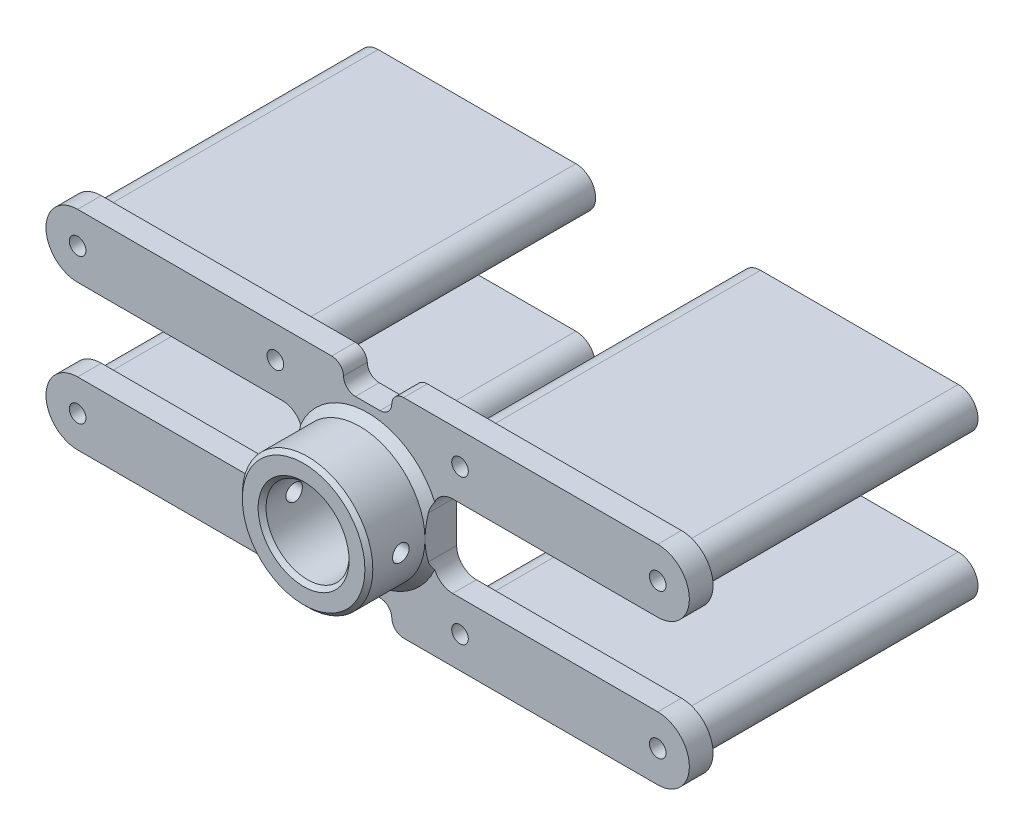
SolidWorks part; units mm, degrees
ref_plane "Top Plane" through (0, 0, 0) normal (0, 0, 1) x (1, 0, 0)
ref_plane "Front Plane" through (0, 0, 0) normal (0, 1, 0) x (1, 0, 0)
ref_plane "Right Plane" through (0, 0, 0) normal (1, 0, 0) x (0, 0, -1)
sketch "Sketch11" plane through (0, 0, 0) normal (0, 0, 1) x (1, 0, 0)
  line L0 (0, 57.5672) -> (0, -57.5672) construction
  line L1 (-89.7236, 0) -> (89.7236, 0) construction
  line L2 (-73.35, 18.35) -> (-23.35, 18.35) construction
  line L3 (-73.35, 23.35) -> (-23.35, 23.35)
  line L4 (-73.35, 13.35) -> (-23.35, 13.35)
  line L5 (-18.35, 18.35) -> (-18.35, 0) construction
  line L6 (-18.35, 18.35) -> (0, 18.35) construction
  line L7 (-73.35, -18.35) -> (-23.35, -18.35) construction
  line L8 (-73.35, -23.35) -> (-23.35, -23.35)
  line L9 (-73.35, -13.35) -> (-23.35, -13.35)
  line L10 (73.35, 18.35) -> (23.35, 18.35) construction
  line L11 (73.35, 23.35) -> (23.35, 23.35)
  line L12 (73.35, 13.35) -> (23.35, 13.35)
  line L13 (73.35, -18.35) -> (23.35, -18.35) construction
  line L14 (73.35, -23.35) -> (23.35, -23.35)
  line L15 (73.35, -13.35) -> (23.35, -13.35)
  arc A0 (-73.35, 23.35) -> (-73.35, 13.35) centre (-73.35, 18.35) ccw
  arc A1 (-23.35, 13.35) -> (-23.35, 23.35) centre (-23.35, 18.35) ccw
  arc A2 (-73.35, -23.35) -> (-73.35, -13.35) centre (-73.35, -18.35) cw
  arc A3 (-23.35, -13.35) -> (-23.35, -23.35) centre (-23.35, -18.35) cw
  arc A4 (73.35, 23.35) -> (73.35, 13.35) centre (73.35, 18.35) cw
  arc A5 (23.35, 13.35) -> (23.35, 23.35) centre (23.35, 18.35) cw
  arc A6 (73.35, -23.35) -> (73.35, -13.35) centre (73.35, -18.35) ccw
  arc A7 (23.35, -13.35) -> (23.35, -23.35) centre (23.35, -18.35) ccw
  point P4 (0, 0)
  point P8 (0, 0)
  point P10 (-48.35, 18.35)
  point P19 (-48.35, -18.35)
  point P26 (48.35, 18.35)
  point P33 (48.35, -18.35)
extrude "Boss-Extrude6" add sketch "Sketch11" along normal blind 70
sketch "Sketch12" plane through (0, 0, 70) normal (0, 0, 1) x (1, 0, 0)
  line L0 (73.35, -13.35) -> (23.35, -13.35) construction
  line L1 (23.35, -23.35) -> (73.35, -23.35) construction
  line L2 (73.35, 23.35) -> (23.35, 23.35) construction
  line L3 (23.35, 13.35) -> (73.35, 13.35) construction
  line L4 (-73.35, 13.35) -> (-23.35, 13.35) construction
  line L5 (-23.35, 23.35) -> (-73.35, 23.35) construction
  line L6 (-73.35, -23.35) -> (-23.35, -23.35) construction
  line L7 (-23.35, -13.35) -> (-73.35, -13.35) construction
  line L8 (73.35, -13.35) -> (23.35, -13.35) construction
  line L9 (23.35, -23.35) -> (73.35, -23.35) construction
  line L10 (73.35, 23.35) -> (23.35, 23.35) construction
  line L11 (23.35, 13.35) -> (73.35, 13.35) construction
  line L12 (-73.35, 13.35) -> (-23.35, 13.35) construction
  line L13 (-23.35, 23.35) -> (-73.35, 23.35) construction
  line L14 (-73.35, -23.35) -> (-23.35, -23.35) construction
  line L15 (-23.35, -13.35) -> (-73.35, -13.35) construction
  line L16 (-73.35, -26.35) -> (-23.35, -26.35)
  line L17 (-21.5, -10.35) -> (-73.35, -10.35)
  line L18 (-23.35, 26.35) -> (-73.35, 26.35)
  line L19 (-73.35, 10.35) -> (-21.5, 10.35)
  line L20 (73.35, 26.35) -> (23.35, 26.35)
  line L21 (21.5, 10.35) -> (73.35, 10.35)
  line L22 (73.35, -10.35) -> (21.5, -10.35)
  line L23 (23.35, -26.35) -> (73.35, -26.35)
  line L24 (-16.5, 5.35) -> (-16.5, -5.35)
  line L25 (-23.35, -26.35) -> (-9.1, -26.35)
  line L26 (16.5, -5.35) -> (16.5, 5.35)
  line L27 (23.35, 26.35) -> (9.1, 26.35)
  line L28 (23.35, 10.35) -> (73.35, 10.35) construction
  line L29 (73.35, -10.35) -> (23.35, -10.35) construction
  line L30 (-23.35, -10.35) -> (-73.35, -10.35) construction
  line L31 (-73.35, 10.35) -> (-23.35, 10.35) construction
  line L32 (0, 10.5) -> (0, 20.5) construction
  line L33 (0, -10.5) -> (0, -20.5) construction
  line L34 (-10.5, 26.35) -> (-10.5, -26.35) construction
  line L35 (10.5, 26.35) -> (10.5, -26.35) construction
  line L36 (-3.1, -20.5) -> (3.1, -20.5)
  line L37 (-3.1, 20.5) -> (3.1, 20.5)
  line L38 (-6.1, 23.5) -> (-6.1, 23.35)
  line L39 (6.1, 23.5) -> (6.1, 23.35)
  line L40 (6.1, -23.5) -> (6.1, -23.35)
  line L41 (-6.1, -23.5) -> (-6.1, -23.35)
  line L42 (-9.1, 26.35) -> (-23.35, 26.35)
  line L43 (9.1, -26.35) -> (23.35, -26.35)
  arc A0 (73.35, -23.35) -> (73.35, -13.35) centre (73.35, -18.35) ccw construction
  arc A1 (23.35, -13.35) -> (23.35, -23.35) centre (23.35, -18.35) ccw construction
  arc A2 (73.35, 13.35) -> (73.35, 23.35) centre (73.35, 18.35) ccw construction
  arc A3 (23.35, 23.35) -> (23.35, 13.35) centre (23.35, 18.35) ccw construction
  arc A4 (-73.35, 23.35) -> (-73.35, 13.35) centre (-73.35, 18.35) ccw construction
  arc A5 (-23.35, 13.35) -> (-23.35, 23.35) centre (-23.35, 18.35) ccw construction
  arc A6 (-73.35, -13.35) -> (-73.35, -23.35) centre (-73.35, -18.35) ccw construction
  arc A7 (-23.35, -23.35) -> (-23.35, -13.35) centre (-23.35, -18.35) ccw construction
  arc A8 (73.35, -23.35) -> (73.35, -13.35) centre (73.35, -18.35) ccw construction
  arc A9 (23.35, -13.35) -> (23.35, -23.35) centre (23.35, -18.35) ccw construction
  arc A10 (73.35, 13.35) -> (73.35, 23.35) centre (73.35, 18.35) ccw construction
  arc A11 (23.35, 23.35) -> (23.35, 13.35) centre (23.35, 18.35) ccw construction
  arc A12 (-73.35, 23.35) -> (-73.35, 13.35) centre (-73.35, 18.35) ccw construction
  arc A13 (-23.35, 13.35) -> (-23.35, 23.35) centre (-23.35, 18.35) ccw construction
  arc A14 (-73.35, -13.35) -> (-73.35, -23.35) centre (-73.35, -18.35) ccw construction
  arc A15 (-23.35, -23.35) -> (-23.35, -13.35) centre (-23.35, -18.35) ccw construction
  circle A16 centre (0, 0) radius 10.5
  arc A17 (-73.35, -10.35) -> (-73.35, -26.35) centre (-73.35, -18.35) ccw
  arc A19 (-73.35, 26.35) -> (-73.35, 10.35) centre (-73.35, 18.35) ccw
  arc A22 (73.35, 10.35) -> (73.35, 26.35) centre (73.35, 18.35) ccw
  arc A24 (73.35, -26.35) -> (73.35, -10.35) centre (73.35, -18.35) ccw
  arc A25 (-23.35, 10.35) -> (-23.35, 26.35) centre (-23.35, 18.35) ccw construction
  arc A26 (-23.35, -26.35) -> (-23.35, -10.35) centre (-23.35, -18.35) ccw construction
  arc A27 (23.35, -10.35) -> (23.35, -26.35) centre (23.35, -18.35) ccw construction
  arc A28 (23.35, 26.35) -> (23.35, 10.35) centre (23.35, 18.35) ccw construction
  arc A29 (16.5, 5.35) -> (21.5, 10.35) centre (21.5, 5.35) cw
  arc A30 (21.5, -10.35) -> (16.5, -5.35) centre (21.5, -5.35) cw
  arc A31 (-21.5, -10.35) -> (-16.5, -5.35) centre (-21.5, -5.35) ccw
  arc A32 (-16.5, 5.35) -> (-21.5, 10.35) centre (-21.5, 5.35) ccw
  arc A33 (9.1, -26.35) -> (6.1, -23.35) centre (9.1, -23.35) cw
  arc A34 (6.1, -23.5) -> (3.1, -20.5) centre (3.1, -23.5) ccw
  arc A35 (-6.1, -23.5) -> (-3.1, -20.5) centre (-3.1, -23.5) cw
  arc A36 (-6.1, -23.35) -> (-9.1, -26.35) centre (-9.1, -23.35) cw
  arc A37 (9.1, 26.35) -> (6.1, 23.35) centre (9.1, 23.35) ccw
  arc A38 (6.1, 23.5) -> (3.1, 20.5) centre (3.1, 23.5) cw
  arc A39 (-3.1, 20.5) -> (-6.1, 23.5) centre (-3.1, 23.5) cw
  arc A40 (-6.1, 23.35) -> (-9.1, 26.35) centre (-9.1, 23.35) ccw
  point P70 (-10.5, 0)
  point P73 (10.5, 0)
  point P76 (0, -20.5)
  point P79 (0, 20.5)
  point P85 (6.1, -26.35)
  point P96 (6.1, 20.5)
  point P99 (-6.1, 20.5)
  point P102 (-6.1, 26.35)
extrude "Boss-Extrude7" add sketch "Sketch12" along normal blind 6 separate body
sketch "Sketch13" plane through (0, 0, 76) normal (0, 0, 1) x (1, 0, 0)
  circle A0 centre (0, 0) radius 10.5 construction
  circle A1 centre (0, 0) radius 10.5
  circle A2 centre (0, 0) radius 16.5
extrude "Boss-Extrude8" add sketch "Sketch13" along normal blind 16.2
sketch "Sketch14" plane through (0, 0, 0) normal (1, 0, 0) x (0, 0, -1)
  line L0 (-76, 0) -> (-76, -16.5) construction
  line L1 (-76, 0) -> (-76, -16.5) construction
  line L2 (-92.2, 16.5) -> (-92.2, -16.5) construction
  line L3 (-92.2, 16.5) -> (-92.2, -16.5) construction
  line L4 (-92.2, 0) -> (-55.527, 0) construction
  circle A0 centre (-84.1, 0) radius 2.1
extrude "Cut-Extrude4" cut sketch "Sketch14" against normal up to surface and the other way up to surface
chamfer "Chamfer1" distance 2 angle 45 6 edges at (-16.5, -2.675, 76) (16.5, 2.675, 76) (0, 16.5, 76) (0, -16.5, 76) (-16.5, 2.675, 76) (16.5, -2.675, 76)
chamfer "Chamfer2" distance 1 angle 45 2 edges at (16.5, 0, 92.2) (10.5, 0, 92.2)
sketch "Sketch15" plane through (0, 0, 76) normal (0, 0, 1) x (1, 0, 0)
  line L0 (-73.35, -23.35) -> (-23.35, -23.35) construction
  line L1 (-23.35, -13.35) -> (-73.35, -13.35) construction
  line L2 (-73.35, 13.35) -> (-23.35, 13.35) construction
  line L3 (-23.35, 23.35) -> (-73.35, 23.35) construction
  line L4 (73.35, 23.35) -> (23.35, 23.35) construction
  line L5 (23.35, 13.35) -> (73.35, 13.35) construction
  line L6 (73.35, -13.35) -> (23.35, -13.35) construction
  line L7 (23.35, -23.35) -> (73.35, -23.35) construction
  line L8 (-73.35, -23.35) -> (-23.35, -23.35) construction
  line L9 (-23.35, -13.35) -> (-73.35, -13.35) construction
  line L10 (-73.35, 13.35) -> (-23.35, 13.35) construction
  line L11 (-23.35, 23.35) -> (-73.35, 23.35) construction
  line L12 (73.35, 23.35) -> (23.35, 23.35) construction
  line L13 (23.35, 13.35) -> (73.35, 13.35) construction
  line L14 (73.35, -13.35) -> (23.35, -13.35) construction
  line L15 (23.35, -23.35) -> (73.35, -23.35) construction
  arc A0 (-73.35, -13.35) -> (-73.35, -23.35) centre (-73.35, -18.35) ccw construction
  arc A1 (-23.35, -23.35) -> (-23.35, -13.35) centre (-23.35, -18.35) ccw construction
  arc A2 (-73.35, 23.35) -> (-73.35, 13.35) centre (-73.35, 18.35) ccw construction
  arc A3 (-23.35, 13.35) -> (-23.35, 23.35) centre (-23.35, 18.35) ccw construction
  arc A4 (73.35, 13.35) -> (73.35, 23.35) centre (73.35, 18.35) ccw construction
  arc A5 (23.35, 23.35) -> (23.35, 13.35) centre (23.35, 18.35) ccw construction
  arc A6 (73.35, -23.35) -> (73.35, -13.35) centre (73.35, -18.35) ccw construction
  arc A7 (23.35, -13.35) -> (23.35, -23.35) centre (23.35, -18.35) ccw construction
  arc A8 (-73.35, -13.35) -> (-73.35, -23.35) centre (-73.35, -18.35) ccw construction
  arc A9 (-23.35, -23.35) -> (-23.35, -13.35) centre (-23.35, -18.35) ccw construction
  arc A10 (-73.35, 23.35) -> (-73.35, 13.35) centre (-73.35, 18.35) ccw construction
  arc A11 (-23.35, 13.35) -> (-23.35, 23.35) centre (-23.35, 18.35) ccw construction
  arc A12 (73.35, 13.35) -> (73.35, 23.35) centre (73.35, 18.35) ccw construction
  arc A13 (23.35, 23.35) -> (23.35, 13.35) centre (23.35, 18.35) ccw construction
  arc A14 (73.35, -23.35) -> (73.35, -13.35) centre (73.35, -18.35) ccw construction
  arc A15 (23.35, -13.35) -> (23.35, -23.35) centre (23.35, -18.35) ccw construction
  circle A16 centre (73.35, -18.35) radius 1.65
  circle A17 centre (23.35, -18.35) radius 1.65
  circle A18 centre (73.35, 18.35) radius 1.65
  circle A19 centre (23.35, 18.35) radius 1.65
  circle A20 centre (-23.35, 18.35) radius 1.65
  circle A21 centre (-73.35, 18.35) radius 1.65
  circle A22 centre (-73.35, -18.35) radius 1.65
  circle A23 centre (-23.35, -18.35) radius 1.65
  dimension "D1" = 3.3
extrude "Cut-Extrude5" cut sketch "Sketch15" against normal blind 30
sketch "Sketch16" plane through (0, 0, 76) normal (0, 0, 1) x (1, 0, 0)
  circle A0 centre (73.35, -18.35) radius 2.1
  circle A1 centre (23.35, -18.35) radius 2.1
  circle A2 centre (-23.35, -18.35) radius 2.1
  circle A3 centre (-73.35, -18.35) radius 2.1
  circle A4 centre (73.35, 18.35) radius 2.1
  circle A5 centre (23.35, 18.35) radius 2.1
  circle A6 centre (-23.35, 18.35) radius 2.1
  circle A7 centre (-73.35, 18.35) radius 2.1
  dimension "D1" = 4.2
extrude "Cut-Extrude6" cut sketch "Sketch16" against normal up to surface (6 mm away)
equation "\"bore-id\"= 15mm"
equation "\"wall-thickness\"= 6mm"
equation "\"wall-depth\"= 4mm"
equation "\"bolt-size\" = 4.2mm"
equation "\"jaw-spread\" = 52mm"
equation "\"jaw-width\" = 25.2mm"
equation "\"jaw-distance\" = 76mm"
equation "\"radius\"= 5mm"
equation "\"jaw-depth\"= 25mm"
equation "\"jaw-clearance\"= 2mm"
equation "\"D1@Sketch11\"= \"jaw-width\" / 2 + \"jaw-clearance\" + \"bore-id\" / 4"
equation "\"D3@Sketch11\"= \"wall-thickness\" + 4"
equation "\"D1@Boss-Extrude6\"= \"jaw-distance\" - \"wall-thickness\""
equation "\"D1@Sketch12\"=\"bore-id\"+\"wall-thickness\""
equation "\"D3@Sketch12\"= \"radius\""
equation "\"D1@Boss-Extrude7\"= \"wall-thickness\""
equation "\"D5@Sketch12\"=\"wall-thickness\""
equation "\"D6@Sketch12\"=\"wall-thickness\""
equation "\"D7@Sketch12\"= \"bolt-size\" + 8"
equation "\"D1@Sketch13\"= \"wall-thickness\""
equation "\"D1@Boss-Extrude8\"= \"bolt-size\" + \"wall-thickness\" * 2"
equation "\"D1@Sketch14\"=\"bolt-size\"/2 +\"wall-thickness\""
equation "\"D2@Sketch14\"=\"bolt-size\""
